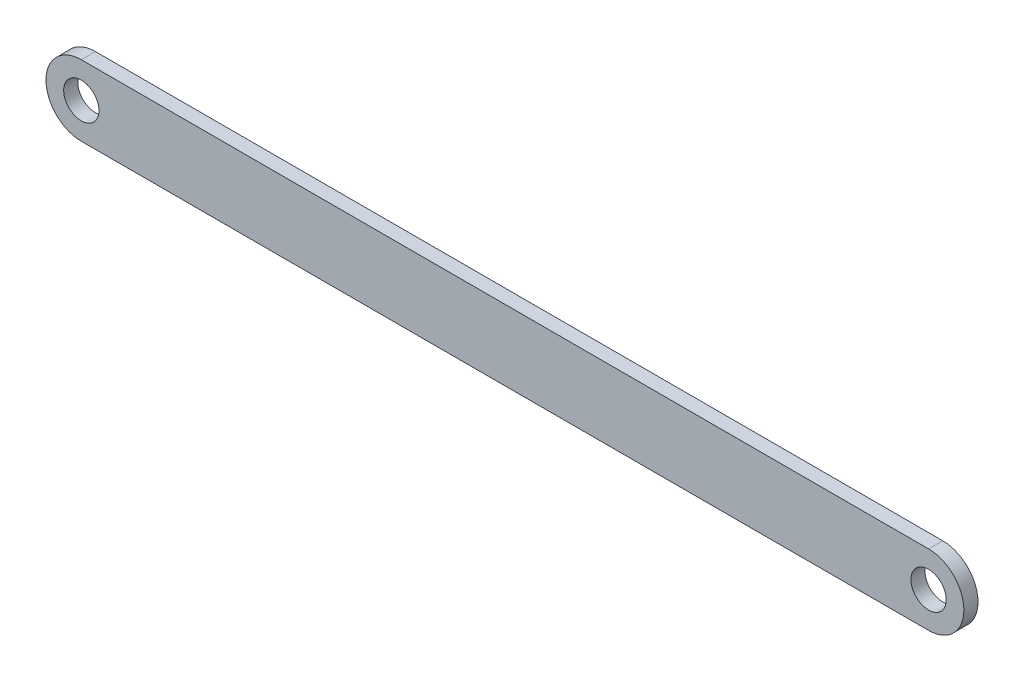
SolidWorks part; units mm, degrees
ref_plane "Front Plane" through (0, 0, 0) normal (0, 0, 1) x (1, 0, 0)
ref_plane "Top Plane" through (0, 0, 0) normal (0, 1, 0) x (1, 0, 0)
ref_plane "Right Plane" through (0, 0, 0) normal (1, 0, 0) x (0, 0, -1)
sketch "Sketch1" plane through (0, 0, 0) normal (0, 0, 1) x (1, 0, 0)
  line L0 (0, 0) -> (152.4, 0) construction
  line L1 (0, 6.35) -> (152.4, 6.35)
  line L2 (0, -6.35) -> (152.4, -6.35)
  arc A0 (0, 6.35) -> (0, -6.35) centre (0, 0) ccw
  arc A1 (152.4, -6.35) -> (152.4, 6.35) centre (152.4, 0) ccw
  circle A2 centre (0, 0) radius 3.175
  circle A3 centre (152.4, 0) radius 3.175
  point P3 (76.2, 0)
  dimension "D2" = 6.35
  dimension "D3" = 6.35
  dimension "D4" = 6.35
  dimension "D1" = 152.4
extrude "Boss-Extrude1" add sketch "Sketch1" along normal blind 2.54
